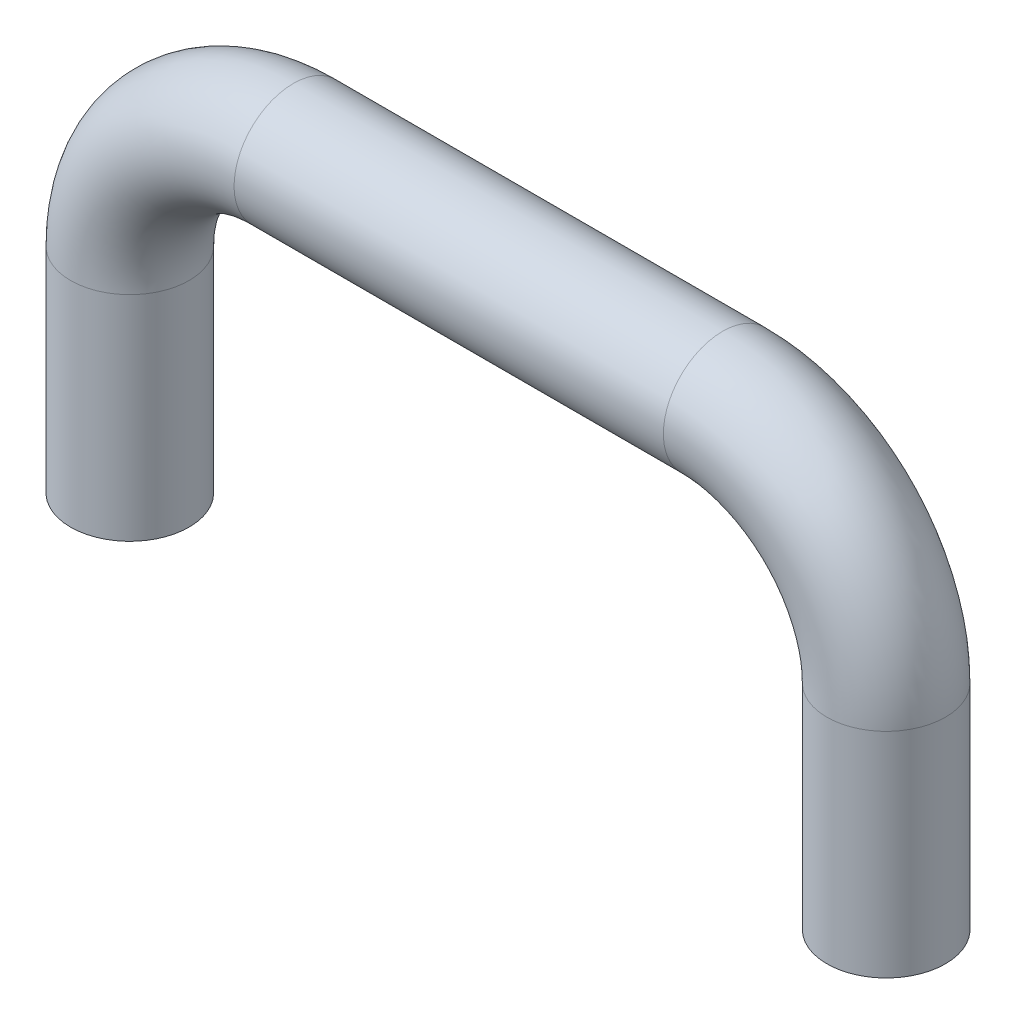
SolidWorks part; units mm, degrees
ref_plane "Plan de face" through (0, 0, 0) normal (0, 0, 1) x (1, 0, 0)
ref_plane "Plan de dessus" through (0, 0, 0) normal (0, 1, 0) x (1, 0, 0)
ref_plane "Plan de droite" through (0, 0, 0) normal (1, 0, 0) x (0, 0, -1)
sketch "Esquisse1" plane through (0, 0, 0) normal (0, 0, 1) x (1, 0, 0)
  line L0 (-50.7333, 10) -> (-50.7333, 114.5)
  line L1 (29.2667, 194.5) -> (239.2667, 194.5)
  line L2 (319.2667, 114.5) -> (319.2667, 10)
  arc A0 (239.2667, 194.5) -> (319.2667, 114.5) centre (239.2667, 114.5) cw
  arc A1 (29.2667, 194.5) -> (-50.7333, 114.5) centre (29.2667, 114.5) ccw
  point P8 (-50.7333, 194.5)
  dimension "D3" = 80
  dimension "D1" = 370
  dimension "D2" = 184.5
  dimension "D4" = 184.5
ref_plane "Plan1" through (0, 70, 0) normal (0, 1, 0) x (-1, 0, 0)
ref_plane "Plan2" through (0, 10, 0) normal (0, 1, 0) x (-1, 0, 0)
sketch "Esquisse2" plane through (0, 10, 0) normal (0, 1, 0) x (-1, 0, 0)
  line L0 (-239.2667, 0) -> (-319.2667, 0) construction
  circle A0 centre (-319.2667, 0) radius 29
  dimension "D1" = 58
sweep "Balayage2" add profiles "Esquisse2" path "Esquisse1"
sketch "Esquisse7" plane through (0, 10, 0) normal (0, -1, 0) x (1, 0, 0)
  circle A0 centre (319.2667, 0) radius 15
  circle A1 centre (-50.7333, 0) radius 15
  dimension "D1" = 30
  dimension "D2" = 30
extrude "Enlèv. mat.-Extru.2" cut sketch "Esquisse7" against normal blind 30
